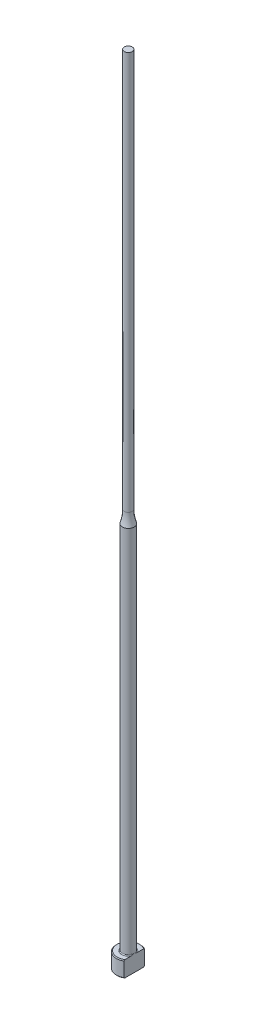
SolidWorks part; units mm, degrees
ref_plane "Front Plane" through (0, 0, 0) normal (0, 0, 1) x (1, 0, 0)
ref_plane "Top Plane" through (0, 0, 0) normal (0, 1, 0) x (1, 0, 0)
ref_plane "Right Plane" through (0, 0, 0) normal (1, 0, 0) x (0, 0, -1)
sketch "Sketch1" plane through (0, 0, 0) normal (0, 0, 1) x (1, 0, 0)
  line L0 (0, 259.9588) -> (0, -15.1925) construction
  line L1 (0, 0) -> (-3, 0)
  line L2 (-3, 0) -> (-3, 4)
  line L3 (-3, 4) -> (-1.5, 4)
  line L4 (-1, 100) -> (-1, 200)
  line L5 (-1, 200) -> (0, 200)
  line L6 (0, 200) -> (0, 0)
  line L7 (-1.5, 4) -> (-1.5, 96.8775)
  arc A0 (-1.5, 96.8775) -> (-1, 100) centre (-11, 100) ccw
  point P13 (-1.5, 0)
  dimension "D1" = 10
  dimension "L" = 200
  dimension "H" = 6
  dimension "T" = 4
  dimension "D" = 2
  dimension "B" = 3
  dimension "S" = 100
revolve "Revolve1" add sketch "Sketch1" angle 360 about L0
chamfer "Chamfer1" distance 0.2 angle 45 2 edges at (0, 4, 3) (0, 0, 3)
fillet "Fillet1" radius 0.2 1 edges at (0, 4, 1.5)
sketch "Sketch2" plane through (0, 0, 0) normal (0, 1, 0) x (1, 0, 0)
  line L0 (1.5, -2.5981) -> (1.5, 2.5981)
  circle A0 centre (0, 0) radius 3 construction
  arc A1 (1.5, -2.5981) -> (1.5, 2.5981) centre (0, 0) ccw
  circle A2 centre (0, 0) radius 1.5 construction
extrude "Keyed Head" cut sketch "Sketch2" along normal through all
